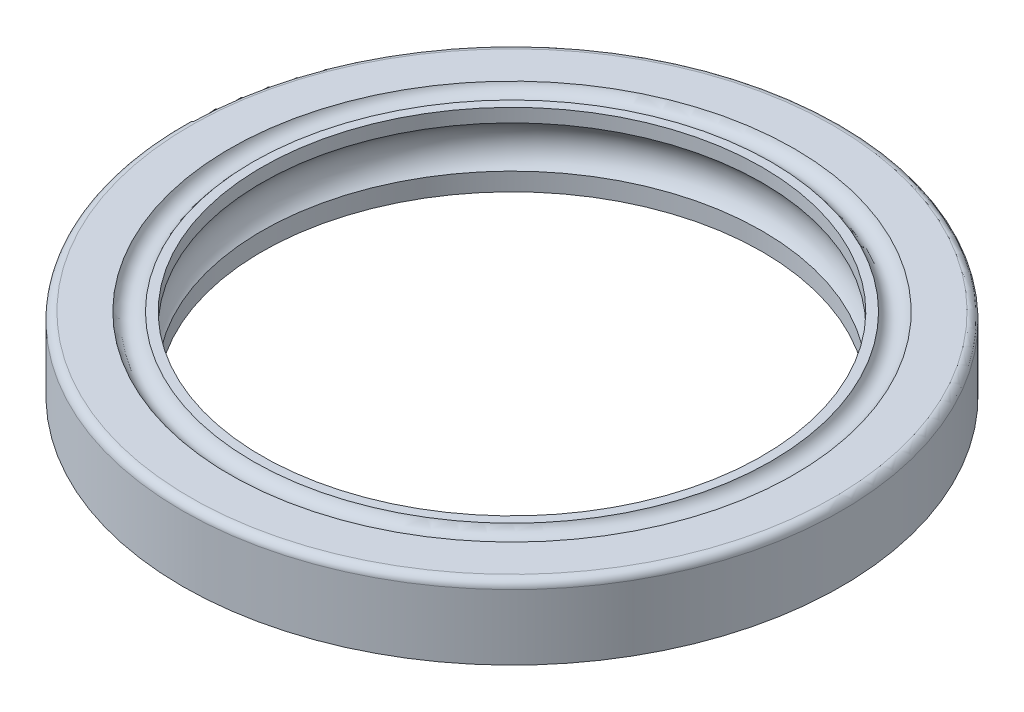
SolidWorks part; units mm, degrees
ref_plane "Front" through (0, 0, 0) normal (0, 0, 1) x (1, 0, 0)
ref_plane "Top" through (0, 0, 0) normal (0, 1, 0) x (1, 0, 0)
ref_plane "Right" through (0, 0, 0) normal (1, 0, 0) x (0, 0, -1)
sketch "Sketch1" plane through (0, 0, 0) normal (0, 0, 1) x (1, 0, 0)
  line L0 (0, 0) -> (0, 30.6659) construction
  line L1 (27.0002, 0) -> (27.0002, 5.3594)
  line L2 (26.3652, 5.9944) -> (23.1268, 5.9944)
  line L3 (20.4978, 5.9944) -> (20.4978, 4.8905)
  line L4 (20.4978, 1.4698) -> (20.4978, 0)
  line L5 (20.4978, 0) -> (22.7154, 0)
  line L6 (22.7154, 0) -> (22.7154, 4.1405)
  line L7 (22.7154, 4.1405) -> (25.6478, 4.1405)
  line L8 (25.6478, 4.1405) -> (25.6478, 0)
  line L9 (25.6478, 0) -> (27.0002, 0)
  line L10 (21.2358, 5.9944) -> (20.4978, 5.9944)
  arc A0 (27.0002, 5.3594) -> (26.3652, 5.9944) centre (26.3652, 5.3594) ccw
  arc A1 (21.2358, 5.9944) -> (23.1268, 5.9944) centre (22.1813, 6.3663) ccw
  arc A2 (20.4978, 1.4698) -> (20.4978, 4.8905) centre (18.9779, 3.1801) ccw
  dimension "D1" = 0.635
  dimension "D2" = 2.032
  dimension "D3" = 5.9944
  dimension "D4" = 27.0002
  dimension "D5" = 20.4978
revolve "Revolve1" add sketch "Sketch1" angle 360 about L0
